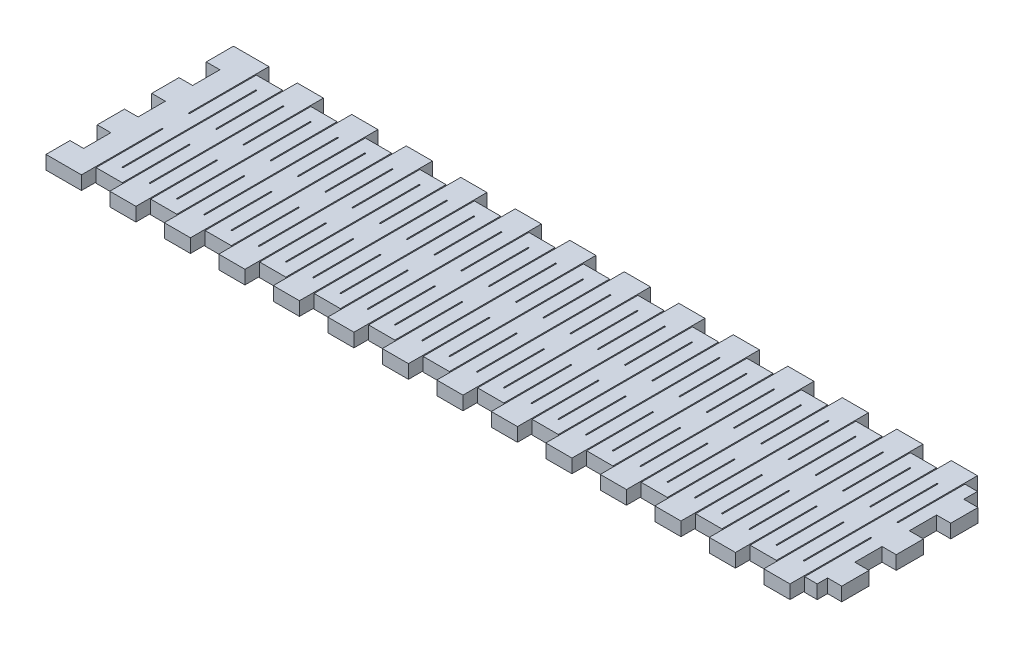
SolidWorks part; units mm, degrees
ref_plane "Front Plane" through (0, 0, 0) normal (0, 0, 1) x (1, 0, 0)
ref_plane "Top Plane" through (0, 0, 0) normal (0, 1, 0) x (1, 0, 0)
ref_plane "Right Plane" through (0, 0, 0) normal (1, 0, 0) x (0, 0, -1)
sketch "Sketch1" plane through (0, 0, 0) normal (0, 1, 0) x (1, 0, 0)
  line L1 (0, 0) -> (179.832, 0)
  line L2 (0, 0) -> (0, 43.688)
  line L3 (0, 43.688) -> (179.832, 43.688)
  line L4 (179.832, 0) -> (179.832, 43.688)
  dimension "D1" = 43.688
  dimension "D2" = 179.832
extrude "body" add sketch "Sketch1" along normal blind 3.175
sketch "Sketch2" plane through (0, 3.175, 0) normal (0, 1, 0) x (1, 0, 0)
  line L0 (8.382, 43.688) -> (8.382, 25.019) construction
  line L2 (8.509, 43.688) -> (8.509, 25.019)
  line L3 (8.255, 43.688) -> (8.255, 25.019)
  line L4 (0, 21.844) -> (179.832, 21.844) construction
  line L5 (0, 43.688) -> (0, 0) construction
  line L6 (179.832, 0) -> (179.832, 43.688) construction
  line L7 (8.382, 0) -> (8.382, 18.669) construction
  line L8 (8.509, 0) -> (8.509, 18.669)
  line L9 (8.255, 0) -> (8.255, 18.669)
  line L10 (11.557, 37.338) -> (11.557, 6.35) construction
  line L11 (11.684, 37.338) -> (11.684, 6.35)
  line L12 (11.43, 37.338) -> (11.43, 6.35)
  arc A0 (8.509, 43.688) -> (8.255, 43.688) centre (8.382, 43.688) ccw
  arc A1 (8.255, 25.019) -> (8.509, 25.019) centre (8.382, 25.019) ccw
  arc A2 (8.509, 0) -> (8.255, 0) centre (8.382, 0) cw
  arc A3 (8.255, 18.669) -> (8.509, 18.669) centre (8.382, 18.669) cw
  arc A4 (11.684, 37.338) -> (11.43, 37.338) centre (11.557, 37.338) ccw
  arc A5 (11.43, 6.35) -> (11.684, 6.35) centre (11.557, 6.35) ccw
  point P4 (8.382, 34.3535)
  point P17 (8.382, 9.3345)
  point P24 (11.557, 21.844)
  dimension "D1" = 0.254
  dimension "D2" = 0.254
  dimension "D3" = 3.175
  dimension "D4" = 8.382
  dimension "D5" = 18.669
  dimension "D6" = 30.988
extrude "slots" cut sketch "Sketch2" against normal up to surface (3.175 mm away)
sketch "Sketch4" plane through (0, 3.175, 0) normal (0, 1, 0) x (1, 0, 0)
  line L0 (0, 21.844) -> (179.832, 21.844) construction
  line L1 (179.832, 43.688) -> (8.509, 43.688) construction
  line L2 (0, 43.688) -> (0, 0) construction
  line L3 (8.382, 43.688) -> (14.732, 43.688)
  line L4 (8.382, 43.688) -> (8.382, 40.513)
  line L6 (179.832, 0) -> (179.832, 43.688) construction
  line L7 (8.382, 40.513) -> (14.732, 40.513)
  line L8 (14.732, 43.688) -> (14.732, 40.513)
  line L9 (14.732, 0) -> (14.732, 3.175)
  line L10 (8.382, 3.175) -> (14.732, 3.175)
  line L11 (8.382, 0) -> (8.382, 3.175)
  line L12 (8.382, 0) -> (14.732, 0)
  point P13 (8.382, 42.1005)
  dimension "D1" = 8.382
  dimension "D2" = 6.35
  dimension "D3" = 3.175
extrude "teeth" cut sketch "Sketch4" against normal up to surface (3.175 mm away)
pattern_linear "teeth pattern" count 14 spacing 12.7 along (1, 0, 0) of "teeth"
pattern_linear "slots pattern" count 69 spacing 6.35 along (1, 0, 0) of "slots"
sketch "Sketch5" plane through (0, 3.175, 0) normal (0, 1, 0) x (1, 0, 0)
  line L0 (0, 43.688) -> (3.175, 43.688)
  line L1 (8.255, 43.688) -> (0, 43.688) construction
  line L2 (3.175, 43.688) -> (3.175, 0)
  line L3 (0, 0) -> (8.255, 0) construction
  line L4 (3.175, 0) -> (0, 0)
  line L8 (0, 0) -> (0, 43.688)
  line L9 (0, 37.338) -> (3.175, 37.338)
  line L10 (0, 30.988) -> (3.175, 30.988)
  line L11 (0, 24.638) -> (3.175, 24.638)
  line L12 (0, 18.288) -> (3.175, 18.288)
  line L13 (0, 11.938) -> (3.175, 11.938)
  line L14 (0, 5.588) -> (3.175, 5.588)
  dimension "D1" = 3.175
  dimension "D2" = 7
extrude "Cut-Extrude3" cut sketch "Sketch5" against normal up to surface (3.175 mm away) contours L8 L10 L2 L9 | L8 L12 L2 L11 | L8 L14 L2 L13
sketch "Sketch6" plane through (0, 3.175, 0) normal (0, 1, 0) x (1, 0, 0)
  line L0 (179.832, 18.796) -> (179.832, 24.892) construction
  line L1 (179.832, 21.844) -> (183.007, 21.844) construction
  line L2 (173.355, 43.688) -> (173.355, 25.019) construction
  line L3 (179.832, 18.796) -> (179.832, 24.892) construction
  line L4 (179.832, 43.688) -> (176.53, 43.688)
  line L5 (176.53, 43.688) -> (176.53, 0)
  line L6 (176.53, 0) -> (179.832, 0)
  line L7 (179.832, 0) -> (179.832, 43.688)
  line L8 (179.832, 37.338) -> (176.53, 37.338)
  line L9 (179.832, 30.988) -> (176.53, 30.988)
  line L10 (179.832, 24.638) -> (176.53, 24.638)
  line L11 (179.832, 18.288) -> (176.53, 18.288)
  line L12 (179.832, 11.938) -> (176.53, 11.938)
  line L13 (179.832, 5.588) -> (176.53, 5.588)
  dimension "D1" = 3.175
  dimension "D3" = 3.175
  dimension "D4" = 0
  dimension "D2" = 7
sketch "Sketch7" plane through (0, 3.175, 0) normal (0, 1, 0) x (1, 0, 0)
  line L0 (179.705, 3.175) -> (173.609, 3.175) construction
  line L1 (175.4112, 40.513) -> (179.832, 40.513)
  line L2 (175.4112, 40.513) -> (175.4112, 3.175)
  line L3 (175.4112, 3.175) -> (179.832, 3.175)
  line L4 (179.832, 40.513) -> (179.832, 3.175)
  line L5 (173.609, 40.513) -> (179.705, 40.513) construction
  line L6 (179.832, 0) -> (179.832, 43.688) construction
extrude "Boss-Extrude1" add sketch "Sketch7" against normal up to surface (3.175 mm away)
extrude "Cut-Extrude4" cut sketch "Sketch6" against normal up to surface (3.175 mm away) contours L8 L7 L4 L5 | L10 L7 L9 L5 | L12 L7 L11 L5 | L7 L13 L5 L6
